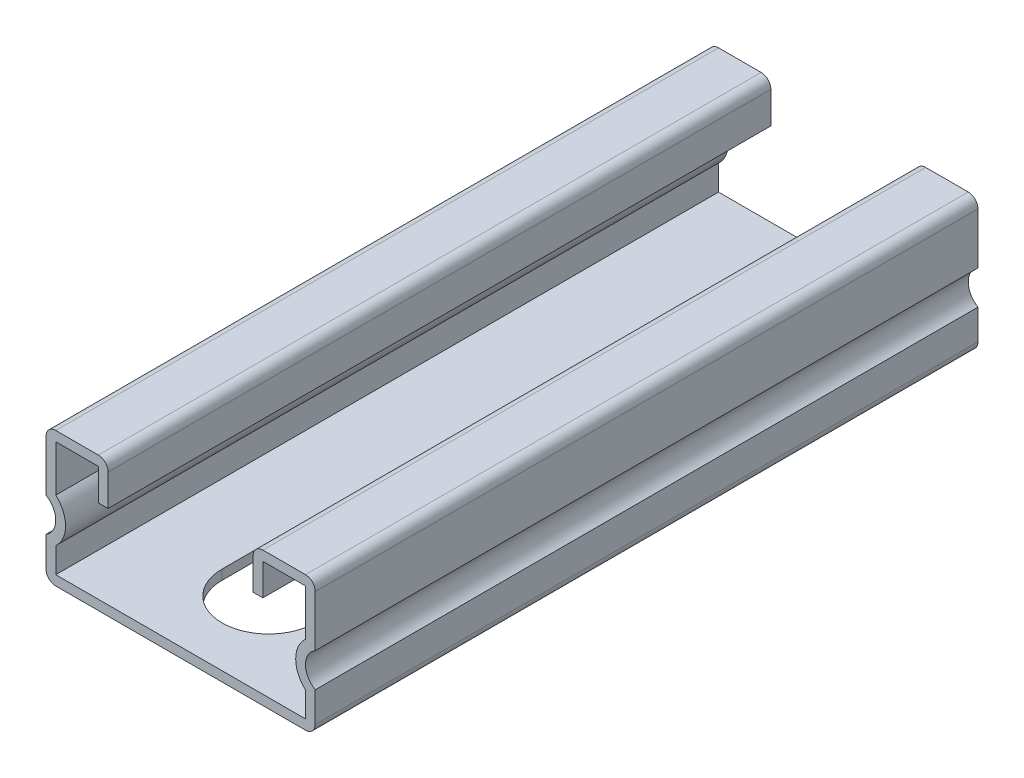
SolidWorks part; units mm, degrees
ref_plane "Plane1" through (0, 0, 0) normal (0, 0, 1) x (1, 0, 0)
ref_plane "Plane2" through (0, 0, 0) normal (0, 1, 0) x (1, 0, 0)
ref_plane "Plane3" through (0, 0, 0) normal (1, 0, 0) x (0, 0, -1)
sketch "Sketch1" plane through (0, 0, 0) normal (0, 0, 1) x (1, 0, 0)
  line L0 (-20.6375, 10.4394) -> (-20.6375, 2.5957)
  line L1 (-20.6375, -2.5957) -> (-20.6375, -7.2136)
  line L2 (-19.1389, -8.7122) -> (19.1389, -8.7122)
  line L3 (20.6375, -7.2136) -> (20.6375, -2.5957)
  line L4 (20.6375, 2.5957) -> (20.6375, 10.4394)
  line L5 (19.1389, 11.938) -> (12.6111, 11.938)
  line L6 (11.1125, 10.4394) -> (11.1125, 5.588)
  line L7 (-19.1389, 11.938) -> (-12.6111, 11.938)
  line L8 (-11.1125, 10.4394) -> (-11.1125, 5.588)
  line L9 (19.1389, -5.2823) -> (19.1389, 6.4389) construction
  line L10 (-19.1389, 6.4389) -> (-19.1389, -5.2823) construction
  line L11 (-12.6111, 10.4394) -> (-12.6111, 5.588)
  line L12 (-19.1389, 10.4394) -> (-12.6111, 10.4394)
  line L13 (-19.1389, 10.4394) -> (-19.1389, 3.351)
  line L14 (-19.1389, -3.351) -> (-19.1389, -7.2136)
  line L15 (-19.1389, -7.2136) -> (19.1389, -7.2136)
  line L16 (19.1389, -7.2136) -> (19.1389, -3.351)
  line L17 (19.1389, 3.351) -> (19.1389, 10.4394)
  line L18 (19.1389, 10.4394) -> (12.6111, 10.4394)
  line L19 (12.6111, 10.4394) -> (12.6111, 5.588)
  line L20 (-12.6111, 5.588) -> (-11.1125, 5.588)
  line L21 (11.1125, 5.588) -> (12.6111, 5.588)
  arc A0 (20.6375, 2.5957) -> (20.6375, -2.5957) centre (22.1361, 0) ccw
  arc A1 (-20.6375, -2.5957) -> (-20.6375, 2.5957) centre (-22.1361, 0) ccw
  arc A2 (-12.6111, 11.938) -> (-11.1125, 10.4394) centre (-12.6111, 10.4394) cw
  arc A3 (-20.6375, 10.4394) -> (-19.1389, 11.938) centre (-19.1389, 10.4394) cw
  arc A4 (-19.1389, -8.7122) -> (-20.6375, -7.2136) centre (-19.1389, -7.2136) cw
  arc A5 (20.6375, -7.2136) -> (19.1389, -8.7122) centre (19.1389, -7.2136) cw
  arc A6 (19.1389, 11.938) -> (20.6375, 10.4394) centre (19.1389, 10.4394) cw
  arc A7 (11.1125, 10.4394) -> (12.6111, 11.938) centre (12.6111, 10.4394) cw
  arc A8 (-19.1389, -3.351) -> (-19.1389, 3.351) centre (-22.1361, 0) ccw
  arc A9 (19.1389, 3.351) -> (19.1389, -3.351) centre (22.1361, 0) ccw
  dimension "D1" = 20.6375
  dimension "D9" = 2.9972
  dimension "D10" = 2.9972
  dimension "Width" = 41.275
  dimension "base" = 8.7122
  dimension "ToeHt" = 11.938
  dimension "D6" = 22.225
  dimension "edge" = 9.525
  dimension "Lip" = 6.35
  dimension "gauge" = 1.4986
extrude "Base-Extrude" add sketch "Sketch1" along normal blind 101.6
extrude "Slot" cut sketch "Sketch2" against normal through all
sketch "Sketch2" plane through (-0.7476, -8.7122, -11.6779) normal (0, -1, 0) x (1, 0, 0)
  line L0 (7.8914, 48.9841) -> (7.8914, 34.6966)
  line L1 (-6.3961, 34.6966) -> (-6.3961, 48.9841)
  arc A0 (-6.3961, 34.6966) -> (7.8914, 34.6966) centre (0.7476, 34.6966) ccw
  arc A1 (7.8914, 48.9841) -> (-6.3961, 48.9841) centre (0.7476, 48.9841) ccw
  dimension "D3" = 14.2875
  dimension "D1" = 23.0188
  dimension "D2" = 14.2875
pattern_linear "LPattern1" count 2 spacing 50.8 along (0, 0, 1) of "Slot"
equation "\"D1@Sketch1\" = \"Width@Sketch1\" / 2"
equation "\"D6@Sketch1\" = \"Width@Sketch1\" - 2 * \"edge@Sketch1\""
equation "\"D10@Sketch1\" = 2 * \"gauge@Sketch1\""
equation "\"D9@Sketch1\" = \"D10@Sketch1\""
equation "\"D1@LPattern1\" = \"D1@Base-Extrude\" / \"D3@LPattern1\""
